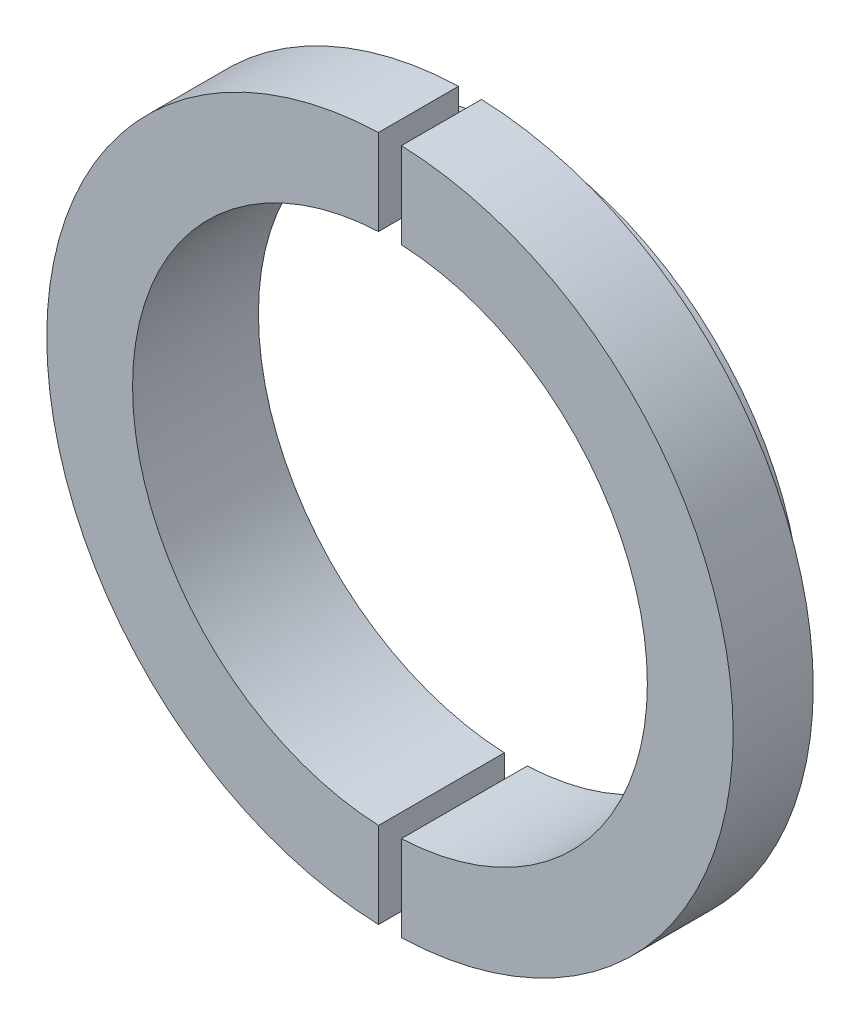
SolidWorks part; units mm, degrees
ref_plane "Plan1" through (0, 0, 0) normal (0, 0, 1) x (1, 0, 0)
ref_plane "Plan2" through (0, 0, 0) normal (0, 1, 0) x (1, 0, 0)
ref_plane "Plan3" through (0, 0, 0) normal (1, 0, 0) x (0, 0, -1)
sketch "Esquisse1" plane through (0, 0, 0) normal (0, 0, 1) x (1, 0, 0)
  circle A0 centre (0, 0) radius 22.5
  circle A1 centre (0, 0) radius 30
  dimension "D1" = 45
  dimension "D2" = 60
extrude "Base-Extrusion" add sketch "Esquisse1" along normal blind 11
sketch "Esquisse2" plane through (0, 0, 0) normal (0, 0, -1) x (-1, 0, 0)
  circle A1 centre (0, 0) radius 30 construction
  circle A2 centre (0, 0) radius 25
  circle A3 centre (0, 0) radius 30
  dimension "D1" = 50
extrude "Enlèv. mat.-Extru.1" cut sketch "Esquisse2" against normal blind 4
sketch "Esquisse3" plane through (0, 0, 11) normal (0, 0, 1) x (1, 0, 0)
  line L0 (0, 33.3795) -> (0, -32.3224) construction
  line L2 (-1, 30) -> (1, 30)
  line L3 (-1, 30) -> (-1, -30)
  line L4 (-1, -30) -> (1, -30)
  line L5 (1, 30) -> (1, -30)
  circle A0 centre (0, 0) radius 30 construction
  dimension "D1" = 2
extrude "Enlèv. mat.-Extru.2" cut sketch "Esquisse3" against normal through all
